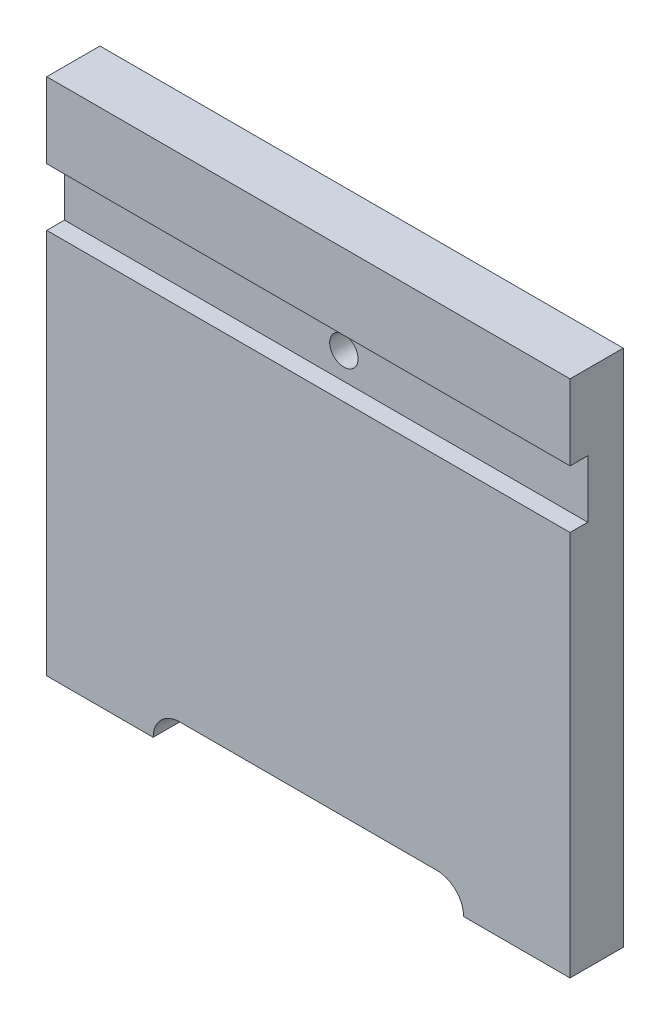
SolidWorks part; units mm, degrees
ref_plane "Plan de face" through (0, 0, 0) normal (0, 0, 1) x (1, 0, 0)
ref_plane "Plan de dessus" through (0, 0, 0) normal (0, 1, 0) x (1, 0, 0)
ref_plane "Plan de droite" through (0, 0, 0) normal (1, 0, 0) x (0, 0, -1)
sketch "Esquisse1" plane through (0, 0, 0) normal (0, 0, 1) x (1, 0, 0)
  line L1 (-9, 18.5) -> (50, 18.5)
  line L2 (-9, 18.5) -> (-9, -40)
  line L3 (-9, -40) -> (50, -40)
  line L4 (50, 18.5) -> (50, -40)
  dimension "D1" = 58.5
  dimension "D2" = 59
extrude "Extrusion1" add sketch "Esquisse1" along normal blind 6
sketch "Esquisse2" plane through (0, 0, 6) normal (0, 0, 1) x (1, 0, 0)
  line L0 (-9, -40) -> (50, -40) construction
  line L1 (3, -40) -> (38, -40)
  line L2 (3, -40) -> (3, -37)
  line L3 (3, -37) -> (38, -37)
  line L4 (38, -40) -> (38, -37)
  line L5 (-9, 18.5) -> (-9, -40) construction
  line L6 (50, -40) -> (50, 18.5) construction
  dimension "D1" = 12
  dimension "D2" = 12
  dimension "D3" = 3
extrude "Enlèv. mat.-Extru.1" cut sketch "Esquisse2" against normal blind 6
fillet "Congé1" radius 3 6 edges at (3, -38.5, 0) (3, -37, 3) (38, -38.5, 0) (38, -37, 3) (3, -38.5, 6) (38, -38.5, 6)
sketch "Esquisse3" plane through (0, 0, 6) normal (0, 0, 1) x (1, 0, 0)
  line L0 (50, -40) -> (50, 18.5) construction
  line L1 (50, 10) -> (-9, 10)
  line L2 (50, 10) -> (50, 3.5)
  line L3 (50, 3.5) -> (-9, 3.5)
  line L4 (-9, 10) -> (-9, 3.5)
  line L5 (-9, 18.5) -> (-9, -40) construction
  line L7 (50, 18.5) -> (-9, 18.5) construction
  dimension "D1" = 15
  dimension "D2" = 6.5
extrude "Enlèv. mat.-Extru.2" cut sketch "Esquisse3" against normal blind 2
sketch "Esquisse4" plane through (0, 0, 4) normal (0, 0, 1) x (1, 0, 0)
  line L1 (50, 3.5) -> (50, 10) construction
  line L2 (-9, 3.5) -> (50, 3.5) construction
  circle A1 centre (22.5, 6.5) radius 1.6
  dimension "D1" = 27.5
  dimension "D2" = 3
extrude "Enlèv. mat.-Extru.3" cut sketch "Esquisse4" against normal through all
